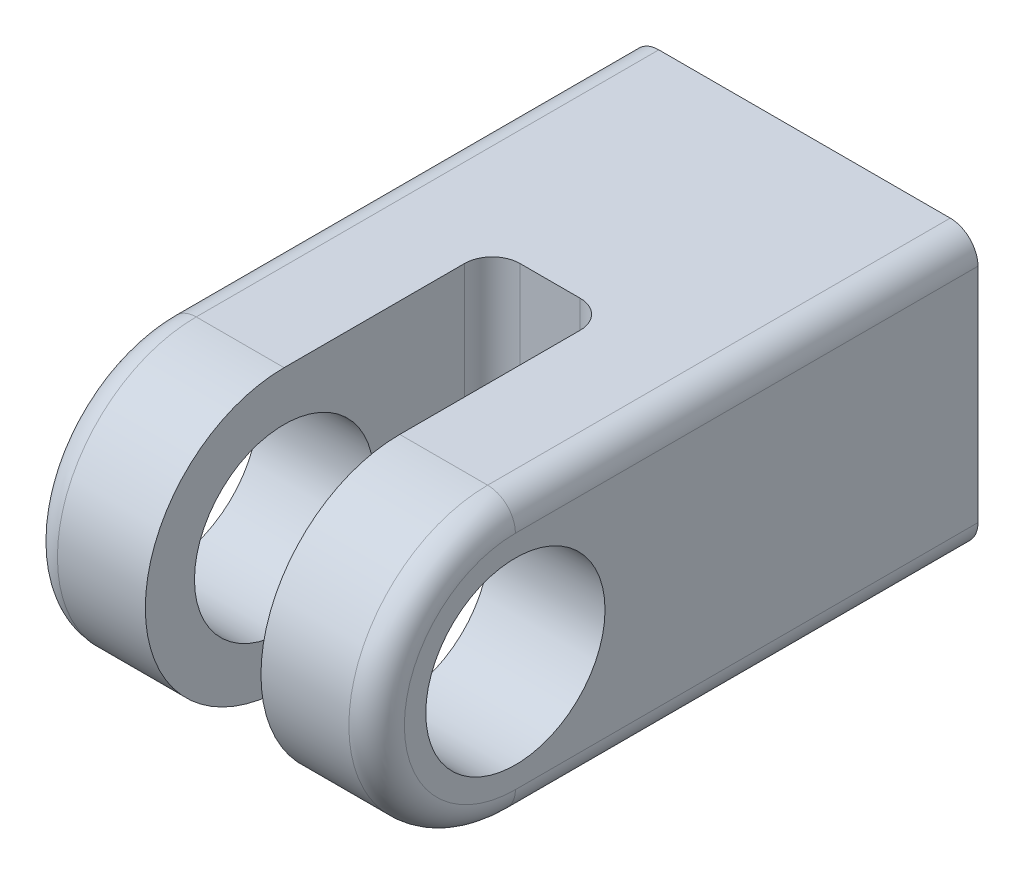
SolidWorks part; units mm, degrees
ref_plane "Front" through (0, 0, 0) normal (0, 0, 1) x (1, 0, 0)
ref_plane "Top" through (0, 0, 0) normal (0, 1, 0) x (1, 0, 0)
ref_plane "Right" through (0, 0, 0) normal (1, 0, 0) x (0, 0, -1)
sketch "Sketch1" plane through (0, 0, 0) normal (1, 0, 0) x (0, 0, -1)
  line L0 (0, 0) -> (-89.4455, 0) construction
  line L1 (0, 7.62) -> (-25.4, 7.62)
  line L2 (0, -7.62) -> (-25.4, -7.62)
  line L3 (0, 7.62) -> (0, -7.62)
  arc A0 (-25.4, 7.62) -> (-25.4, -7.62) centre (-25.4, 0) ccw
  dimension "D1" = 7.62
  dimension "D2" = 15.24
  dimension "D3" = 25.4
extrude "Extrude1" add sketch "Sketch1" along normal mid plane 19.05
sketch "Sketch2" plane through (0, 0, 0) normal (0, 1, 0) x (1, 0, 0)
  line L0 (-9.525, -33.02) -> (9.525, -33.02) construction
  line L1 (-3.175, -13.97) -> (3.175, -13.97)
  line L2 (-3.175, -13.97) -> (-3.175, -33.02)
  line L3 (-3.175, -33.02) -> (3.175, -33.02)
  line L4 (3.175, -13.97) -> (3.175, -33.02)
  line L5 (0, 0) -> (0, -33.02) construction
  dimension "D1" = 6.35
  dimension "D2" = 19.05
extrude "Cut-Extrude1" cut sketch "Sketch2" against normal through all and the other way through all
sketch "Sketch3" plane through (9.525, 0, 0) normal (1, 0, 0) x (0, 0, -1)
  circle A0 centre (-25.4, 0) radius 4.9213
  dimension "D1" = 9.8425
extrude "Cut-Extrude2" cut sketch "Sketch3" against normal through all
sketch "Sketch4" plane through (0, 0, 0) normal (0, 0, -1) x (-1, 0, 0)
  circle A0 centre (0, 0) radius 6.35
  dimension "D1" = 12.7
extrude "Cut-Extrude3" cut sketch "Sketch4" against normal blind 9.8425
fillet "Fillet1" radius 1.524 8 edges at (9.525, 0, 33.02) (9.525, -7.62, 12.7) (3.175, 0, 13.97) (-3.175, 0, 13.97) (-9.525, -7.62, 12.7) (-9.525, 0, 33.02) (-9.525, 7.62, 12.7) (9.525, 7.62, 12.7)
